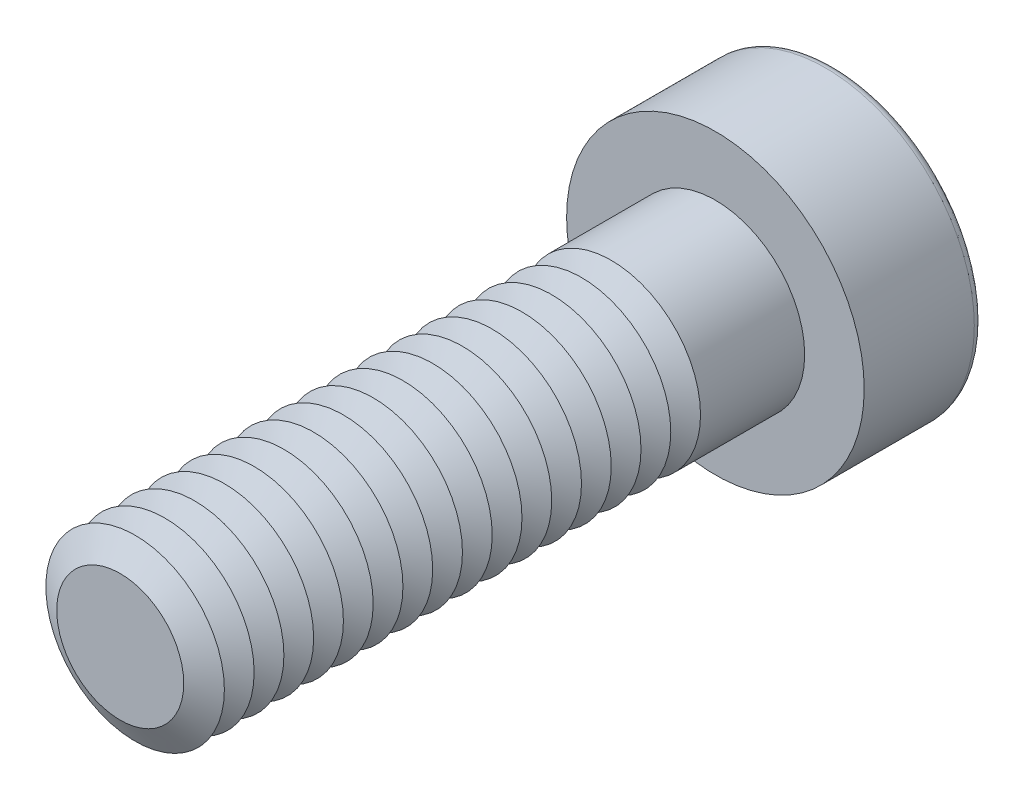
SolidWorks part; units mm, degrees
ref_plane "Front Plane" through (0, 0, 0) normal (0, 0, 1) x (1, 0, 0)
ref_plane "Top Plane" through (0, 0, 0) normal (0, 1, 0) x (1, 0, 0)
ref_plane "Right Plane" through (0, 0, 0) normal (1, 0, 0) x (0, 0, -1)
sketch "Sketch1" plane through (0, 0, 0) normal (0, 0, 1) x (1, 0, 0)
  circle A0 centre (0, 0) radius 3
  dimension "D1" = 6
extrude "Boss-Extrude1" add sketch "Sketch1" along normal blind 20
sketch "Sketch2" plane through (0, 0, 0) normal (0, 0, -1) x (-1, 0, 0)
  circle A0 centre (0, 0) radius 5
  dimension "D1" = 10
extrude "Boss-Extrude2" add sketch "Sketch2" along normal blind 4
sketch "Sketch3" plane through (0, 0, -4) normal (0, 0, -1) x (-1, 0, 0)
  line L1 (-1.1547, 2) -> (-2.3094, 0)
  line L2 (-2.3094, 0) -> (-1.1547, -2)
  line L3 (-1.1547, -2) -> (1.1547, -2)
  line L4 (1.1547, -2) -> (2.3094, 0)
  line L5 (2.3094, 0) -> (1.1547, 2)
  line L6 (1.1547, 2) -> (-1.1547, 2)
  circle A0 centre (0, 0) radius 2 construction
  dimension "D1" = 4
extrude "Cut-Extrude1" cut sketch "Sketch3" against normal blind 3
fillet "Fillet1" radius 0.3 1 edges at (-5, 0, -4)
sketch "Sketch4" plane through (0, 0, -1) normal (0, 0, -1) x (-1, 0, 0)
  line L0 (1.1547, -2) -> (2.3094, 0) construction
  circle A0 centre (0, 0) radius 2
extrude "Cut-Extrude2" cut sketch "Sketch4" against normal through all draft 60
sketch "Sketch5" plane through (0, 0, -4) normal (0, 0, -1) x (-1, 0, 0)
  circle A0 centre (0, 0) radius 2.3094
extrude "Cut-Extrude3" cut sketch "Sketch5" against normal through all draft 75
sketch "Sketch7" plane through (0, 0, 0) normal (1, 0, 0) x (0, 0, -1)
  line L25 (-20, 2.134) -> (-19.5, 3)
  line L26 (-20, 3) -> (-20, -3) construction
  line L27 (-19.5, 3) -> (-20.5, 3)
  line L28 (-20.5, 3) -> (-20, 2.134)
  line L29 (0, 3) -> (-20, 3) construction
  dimension "D1" = 1
revolve "Cut-Revolve1" cut sketch "Sketch7" angle 360 about axis through (0, 0, 20) along (0, 0, -1)
pattern_linear "LPattern1" count 17 spacing 1 along (0, 0, -1) of "Cut-Revolve1"
